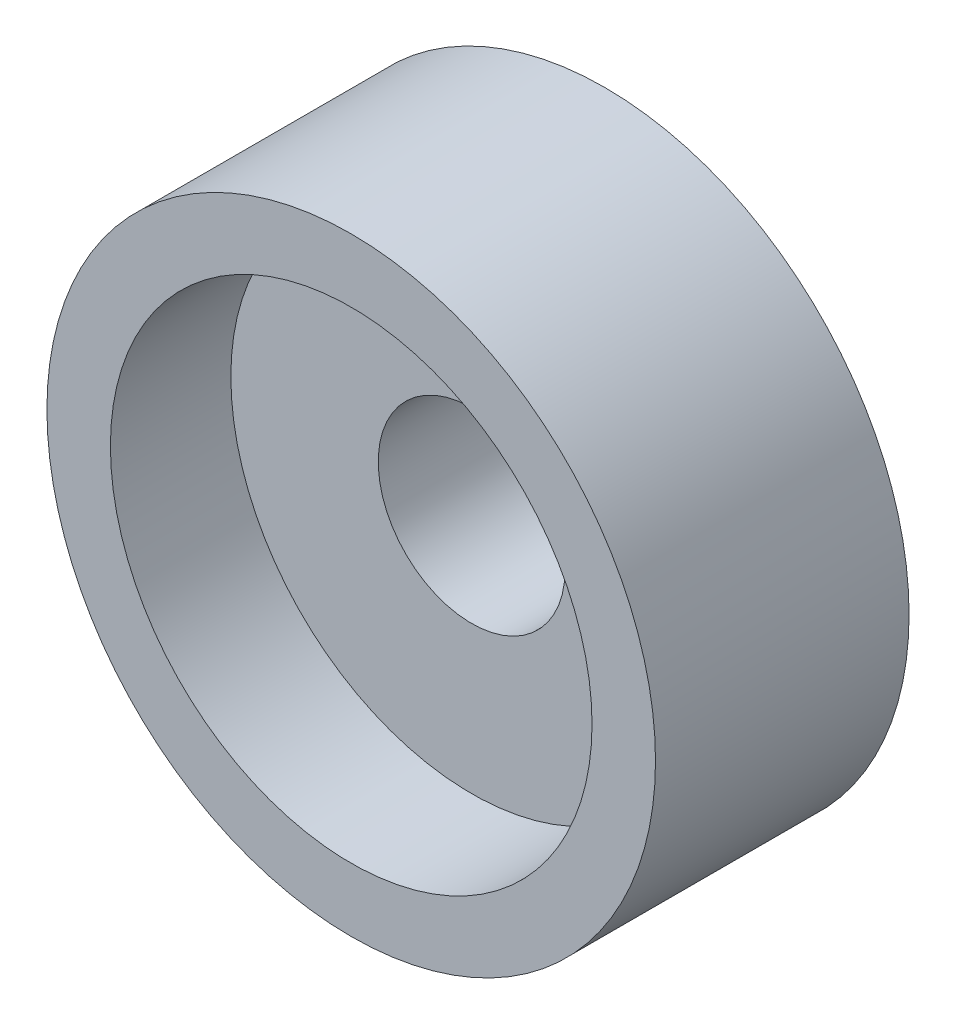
SolidWorks part; units mm, degrees
ref_plane "Front" through (0, 0, 0) normal (0, 0, 1) x (1, 0, 0)
ref_plane "Top" through (0, 0, 0) normal (0, 1, 0) x (1, 0, 0)
ref_plane "Right" through (0, 0, 0) normal (1, 0, 0) x (0, 0, -1)
sketch "Sketch1" plane through (0, 0, 0) normal (0, 0, 1) x (1, 0, 0)
  circle A0 centre (0, 0) radius 24
  dimension "D1" = 48
extrude "Extrude1" add sketch "Sketch1" along normal blind 20
sketch "Sketch2" plane through (0, 0, 20) normal (0, 0, 1) x (1, 0, 0)
  circle A0 centre (0, 0) radius 18.9935
extrude "Cut-Extrude1" cut sketch "Sketch2" against normal blind 9.5
sketch "Sketch3" plane through (0, 0, 10.5) normal (0, 0, 1) x (1, 0, 0)
  circle A0 centre (0, 0) radius 7.3675
extrude "Cut-Extrude2" cut sketch "Sketch3" against normal through all
